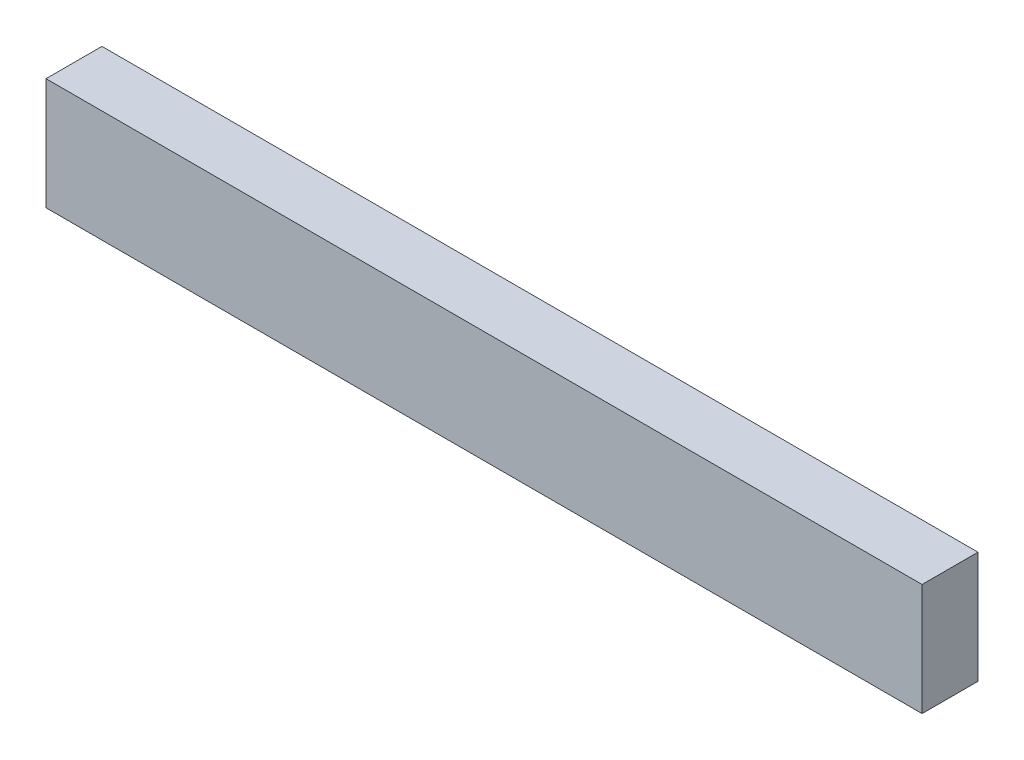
SolidWorks part; units mm, degrees
ref_plane "Front Plane" through (0, 0, 0) normal (0, 0, 1) x (1, 0, 0)
ref_plane "Top Plane" through (0, 0, 0) normal (0, 1, 0) x (1, 0, 0)
ref_plane "Right Plane" through (0, 0, 0) normal (1, 0, 0) x (0, 0, -1)
sketch "Sketch1" plane through (0, 0, 0) normal (1, 0, 0) x (0, 0, -1)
  line L1 (0, 0) -> (19.05, 0)
  line L2 (0, 0) -> (0, 38.1)
  line L3 (0, 38.1) -> (19.05, 38.1)
  line L4 (19.05, 0) -> (19.05, 38.1)
  dimension "D1" = 19.05
  dimension "D2" = 38.1
extrude "Extrude1" add sketch "Sketch1" along normal blind 298.45
